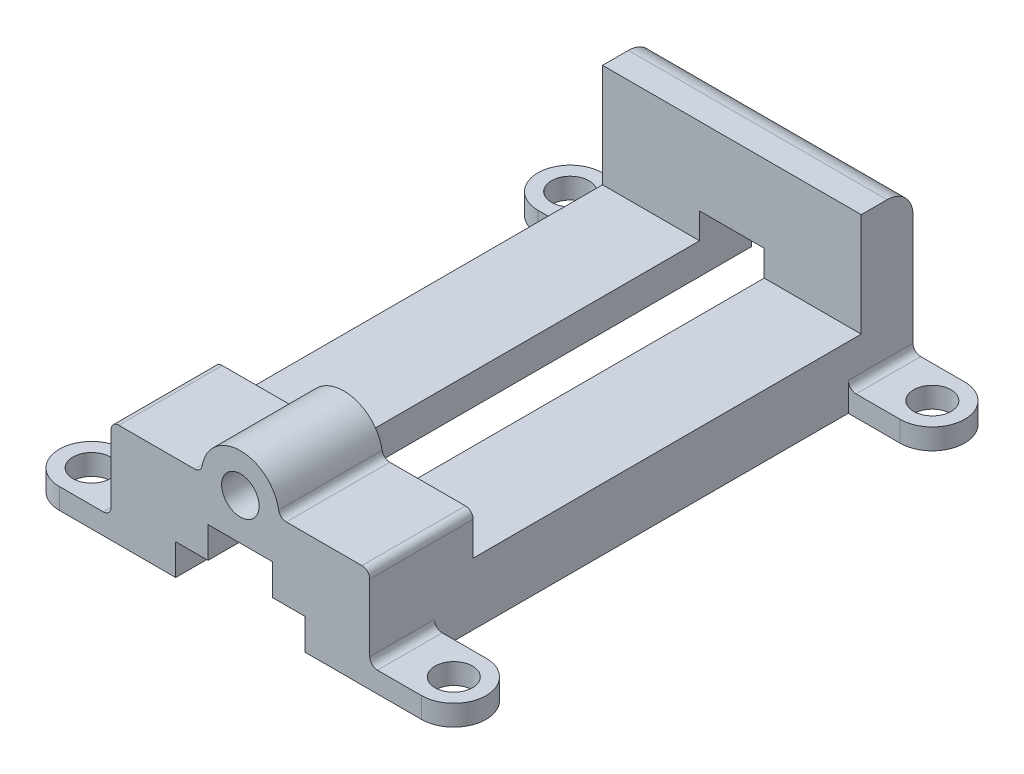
SolidWorks part; units mm, degrees
ref_plane "Front Plane" through (0, 0, 0) normal (0, 0, 1) x (1, 0, 0)
ref_plane "Top Plane" through (0, 0, 0) normal (0, 1, 0) x (1, 0, 0)
ref_plane "Right Plane" through (0, 0, 0) normal (1, 0, 0) x (0, 0, -1)
sketch "Sketch1" plane through (0, 0, 0) normal (0, 0, 1) x (1, 0, 0)
  line L0 (0, 0) -> (0, 72.5365) construction
  line L1 (-25, 0) -> (-50, 0)
  line L2 (25, 0) -> (50, 0)
  line L3 (-50, 0) -> (-50, 40)
  line L4 (50, 0) -> (50, 40)
  line L5 (-50, 40) -> (-15, 40)
  line L6 (50, 40) -> (15, 40)
  line L7 (-25, 0) -> (-25, 12)
  line L8 (25, 0) -> (25, 12)
  line L9 (-25, 12) -> (-12.5, 12)
  line L10 (25, 12) -> (12.5, 12)
  line L11 (-12.5, 12) -> (-12.5, 24)
  line L12 (12.5, 12) -> (12.5, 24)
  line L13 (-12.5, 24) -> (12.5, 24)
  arc A0 (-15, 40) -> (15, 40) centre (0, 40) cw
  point P17 (0, 24)
  point P18 (0, 24)
  dimension "D7" = 15
  dimension "D1" = 100
  dimension "D2" = 50
  dimension "D3" = 12
  dimension "D4" = 24
  dimension "D5" = 25
  dimension "D6" = 40
extrude "Extrude1" add sketch "Sketch1" against normal blind 210
sketch "Sketch2" plane through (50, 0, 0) normal (1, 0, 0) x (0, 0, -1)
  line L1 (40, 24) -> (190, 24)
  line L2 (40, 24) -> (40, 55)
  line L3 (40, 55) -> (190, 55)
  line L4 (190, 24) -> (190, 55)
  line L5 (210, 55) -> (0, 55) construction
  line L7 (0, 0) -> (0, 40) construction
  line L8 (210, 0) -> (210, 40) construction
  line L9 (210, 24) -> (0, 24) construction
  dimension "D2" = 20
  dimension "D3" = 40
extrude "Cut-Extrude1" cut sketch "Sketch2" against normal up to next
sketch "Sketch4" plane through (0, 0, -190) normal (0, 0, 1) x (1, 0, 0)
  line L1 (-50, 24) -> (50, 24)
  line L2 (-50, 24) -> (-50, 64)
  line L3 (-50, 64) -> (50, 64)
  line L4 (50, 24) -> (50, 64)
  dimension "D1" = 40
extrude "Extrude2" add sketch "Sketch4" against normal up to vertex (20 mm away)
sketch "Sketch5" plane through (0, 0, -190) normal (0, 0, 1) x (1, 0, 0)
  line L1 (-12.5, 24) -> (12.5, 24)
  line L2 (-12.5, 24) -> (-12.5, 34)
  line L3 (-12.5, 34) -> (12.5, 34)
  line L4 (12.5, 24) -> (12.5, 34)
  dimension "D1" = 10
extrude "Cut-Extrude2" cut sketch "Sketch5" against normal up to next
fillet "Fillet1" radius 10 1 edges at (0, 64, -210)
hole_wizard "M16x1.5 Tapped Hole1" positions "Sketch7" profile "Sketch6" tap size "M16x1.5" standard "Ansi Metric"
sketch "Sketch7" plane through (0, 0, 0) normal (0, 0, 1) x (1, 0, 0)
  point P0 (0, 40)
sketch "Sketch6" plane through (0, 40, 0) normal (1, 0, 0) x (0, -1, 0)
  line L0 (0, 0) -> (0, 40.8562)
  line L1 (0, 40.8562) -> (7.25, 36.5)
  line L2 (7.25, 36.5) -> (7.25, 0)
  line L5 (7.25, 0) -> (0, 0)
  line L10 (0, 40.8562) -> (-7.25, 36.5) construction
  line L11 (0, -6.35) -> (0, 107.95) construction
  dimension "Tap Drill Dia." = 14.5
  dimension "Tap Drill Depth" = 36.5
  dimension "Drill Angle" = 118
sketch "Sketch8" plane through (0, 0, 0) normal (0, 1, 0) x (1, 0, 0)
  line L0 (50, 0) -> (70, 0)
  line L1 (70, 25) -> (50, 25)
  line L2 (50, 40) -> (50, 0) construction
  line L3 (50, 25) -> (50, 0)
  line L4 (0, 210) -> (0, 0) construction
  line L5 (-50, 210) -> (50, 210) construction
  line L6 (0, 105) -> (101.5827, 105) construction
  line L7 (50, 185) -> (50, 210)
  line L8 (70, 185) -> (50, 185)
  line L9 (50, 210) -> (70, 210)
  line L10 (-50, 25) -> (-50, 0)
  line L11 (-70, 25) -> (-50, 25)
  line L12 (-50, 0) -> (-70, 0)
  line L13 (-50, 210) -> (-70, 210)
  line L14 (-70, 185) -> (-50, 185)
  line L15 (-50, 185) -> (-50, 210)
  arc A0 (70, 0) -> (70, 25) centre (70, 12.5) ccw
  arc A1 (70, 210) -> (70, 185) centre (70, 197.5) cw
  arc A2 (-70, 0) -> (-70, 25) centre (-70, 12.5) cw
  arc A3 (-70, 210) -> (-70, 185) centre (-70, 197.5) ccw
  dimension "D1" = 25
  dimension "D3" = 20
extrude "Extrude3" add sketch "Sketch8" along normal blind 8
hole_wizard "M16x1.5 Tapped Hole2" positions "Sketch10" profile "Sketch9" tap size "M16x1.5" standard "Ansi Metric"
sketch "Sketch10" plane through (0, 8, 0) normal (0, 1, 0) x (-1, 0, 0)
  point P0 (-70, -12.5)
  point P4 (-70, -197.5)
  point P7 (70, -197.5)
  point P10 (70, -12.5)
sketch "Sketch9" plane through (70, 8, -12.5) normal (1, 0, 0) x (0, 0, 1)
  line L0 (0, 0) -> (0, 8)
  line L1 (0, 8) -> (7.25, 8)
  line L2 (7.25, 8) -> (7.25, 0)
  line L5 (7.25, 0) -> (0, 0)
  line L11 (0, -6.35) -> (0, 107.95) construction
  dimension "Thru Tap Drill Dia." = 14.5
  dimension "Thru Tap Drill Depth" = 8
fillet "Fillet2" radius 3 8 edges at (-50, 8, -197.5) (-15, 40, -20) (15, 40, -20) (50, 8, -197.5) (50, 40, -20) (-50, 40, -20)
